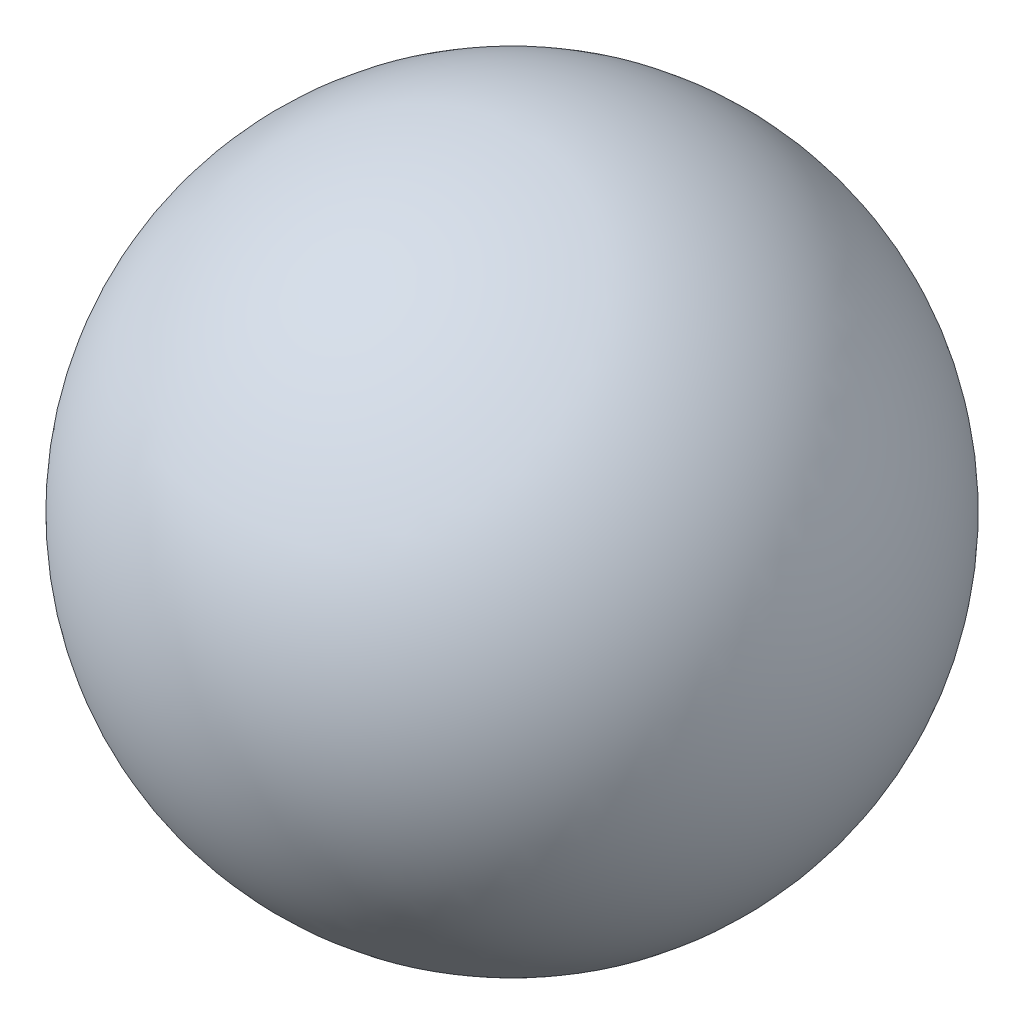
SolidWorks part; units mm, degrees
ref_plane "Front Plane" through (0, 0, 0) normal (0, 0, 1) x (1, 0, 0)
ref_plane "Top Plane" through (0, 0, 0) normal (0, 1, 0) x (1, 0, 0)
ref_plane "Right Plane" through (0, 0, 0) normal (1, 0, 0) x (0, 0, -1)
sketch "Sketch1" plane through (0, 0, 0) normal (0, 0, 1) x (1, 0, 0)
  line L0 (0, 0) -> (0, 12.5) construction
  line L1 (0, 12.5) -> (0, 0)
  spline S0 degree 3 poles (0, 12.5) (1.3694, 12.4734) (2.7605, 9.9792) (0.2166, 4.8127) (2.4023, 3.6251) (0.6916, 0.7485) (0, 0) knots 0 0 0 0 0.518848 0.672856 0.80784 1 1 1 1
extrude "Boss-Extrude1" add sketch "Sketch1" along normal blind 0.2
sketch "Sketch2" plane through (0, 0, 0) normal (-1, 0, 0) x (0, 0, 1)
  line L0 (0.1, 12.5) -> (0.1, 0) construction
  line L1 (0.2, 12.5) -> (0, 12.5) construction
  line L2 (0.2, 0) -> (0, 0) construction
pattern_circular "CirPattern2" count 3 over 360 about axis through (0, 12.5, 0.1) along (0, -1, 0)
combine bodies "Combine2" bodies to combine 101 104 105
other "Flex2" parameters "D0"=90, "D1"=0, "D2"=0
other "Flex3" parameters "D0"=70, "D1"=6.5791, "D2"=0.5966
sketch "Sketch3" plane through (0, 0, 0) normal (0, 0, 1) x (1, 0, 0)
  line L0 (0, 12.5) -> (0, 0) construction
  line L1 (0, 13.25) -> (0, -0.75)
  arc A0 (0, -0.75) -> (0, 13.25) centre (0, 6.25) ccw
revolve "Revolve1" add sketch "Sketch3" angle 360 about L1
move or copy body "Body-Move/Copy1" bodies to move or copy 110 copy no translate (0, -0.4296, 0.2437)
